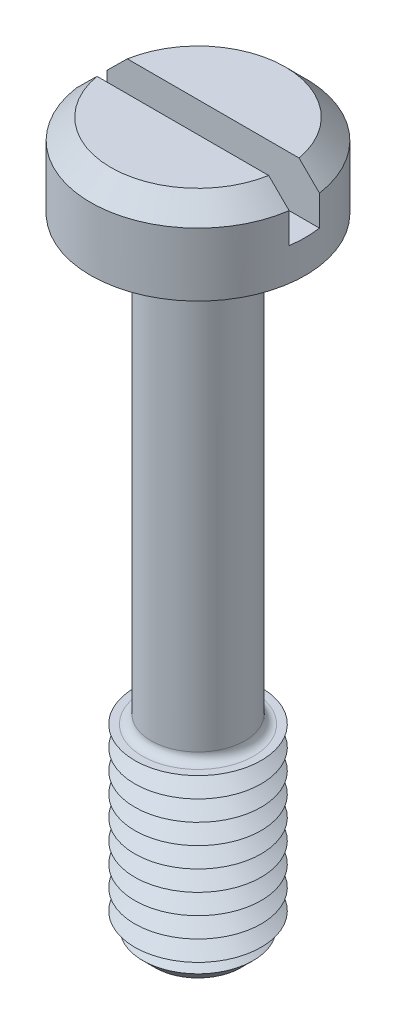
SolidWorks part; units mm, degrees
ref_plane "Front Plane" through (0, 0, 0) normal (0, 0, 1) x (1, 0, 0)
ref_plane "Top Plane" through (0, 0, 0) normal (0, 1, 0) x (1, 0, 0)
ref_plane "Right Plane" through (0, 0, 0) normal (1, 0, 0) x (0, 0, -1)
sketch "Sketch1" plane through (0, 0, 0) normal (0, 1, 0) x (1, 0, 0)
  circle A0 centre (0, 0) radius 4.25
  dimension "D1" = 8.5
extrude "Boss-Extrude1" add sketch "Sketch1" along normal blind 3.3
sketch "Sketch2" plane through (0, 0, 0) normal (0, -1, 0) x (1, 0, 0)
  circle A0 centre (0, 0) radius 1.85
  dimension "D1" = 3.7
extrude "Boss-Extrude2" add sketch "Sketch2" along normal blind 25
sketch "Sketch3" plane through (0, -25, 0) normal (0, -1, 0) x (1, 0, 0)
  circle A0 centre (0, 0) radius 2.5
  dimension "D1" = 5
extrude "Boss-Extrude3" add sketch "Sketch3" against normal blind 7.5
chamfer "Chamfer1" distance 0.8 angle 45 1 edges at (0, -25, -2.5)
sketch "Sketch4" plane through (0, 0, 0) normal (1, 0, 0) x (0, 0, -1)
  line L0 (0, -6.5871) -> (0, -12.0372) construction
sketch "Sketch5" plane through (0, 0, 0) normal (1, 0, 0) x (0, 0, -1)
  line L0 (-2.5, -17.5) -> (-1.8072, -17.9)
  line L1 (-1.8072, -17.9) -> (-2.5, -18.3)
  line L2 (-2.5, -17.5) -> (-2.5, -24.2) construction
  line L3 (-2.5, -18.3) -> (-2.5, -17.5)
  dimension "D1" = 0.8
revolve "Cut-Revolve1" cut sketch "Sketch5" angle 360 about L0
pattern_linear "LPattern1" count 9 spacing 0.8 along (0, -1, 0) of "Cut-Revolve1"
fillet "Fillet1" radius 0.35 2 edges at (0, -17.5, -1.85) (0, 0, -1.85)
chamfer "Chamfer2" distance 0.8 angle 45 1 edges at (0, 3.3, 4.25)
sketch "Sketch6" plane through (0, 3.3, 0) normal (0, 1, 0) x (1, 0, 0)
  line L1 (4.25, -0.6) -> (-4.25, -0.6)
  line L2 (4.25, -0.6) -> (4.25, 0.6)
  line L3 (4.25, 0.6) -> (-4.25, 0.6)
  line L4 (-4.25, -0.6) -> (-4.25, 0.6)
  line L5 (4.25, -0.6) -> (-4.25, 0.6) construction
  line L6 (4.25, 0.6) -> (-4.25, -0.6) construction
  circle A0 centre (0, 0) radius 4.25 construction
  point P0 (0, 0)
  dimension "D1" = 1.2
extrude "Cut-Extrude1" cut sketch "Sketch6" against normal blind 2
